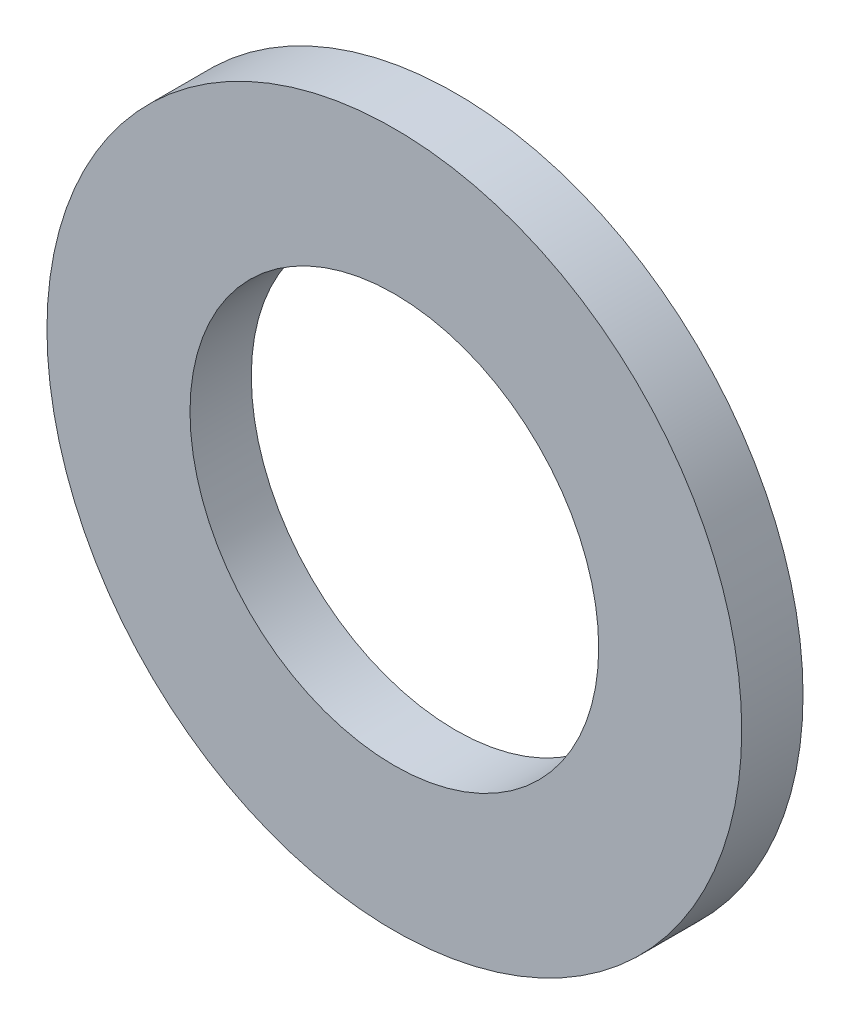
SolidWorks part; units mm, degrees
ref_plane "Plan de face" through (0, 0, 0) normal (0, 0, 1) x (1, 0, 0)
ref_plane "Plan de dessus" through (0, 0, 0) normal (0, 1, 0) x (1, 0, 0)
ref_plane "Plan de droite" through (0, 0, 0) normal (1, 0, 0) x (0, 0, -1)
sketch "Esquisse1" plane through (0, 0, 0) normal (0, 0, 1) x (1, 0, 0)
  circle A0 centre (0, 0) radius 8.5
  circle A1 centre (0, 0) radius 5
  dimension "D1" = 10
  dimension "D2" = 17
extrude "Extrusion1" add sketch "Esquisse1" along normal blind 1.5
